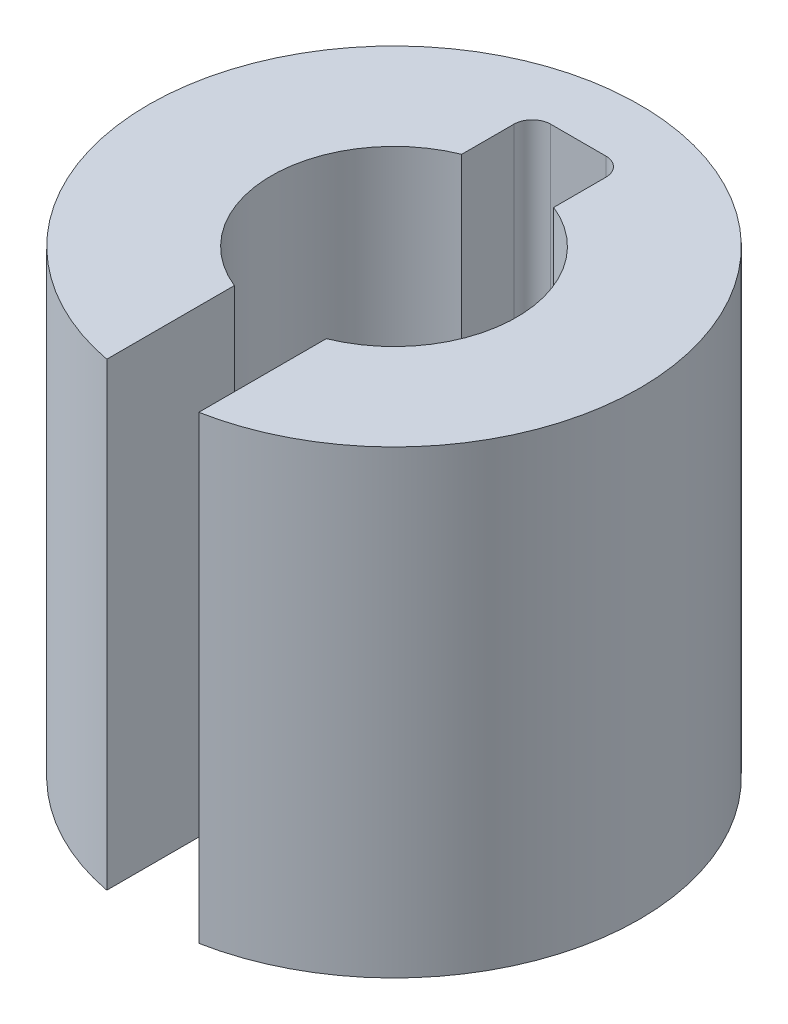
SolidWorks part; units mm, degrees
other "<217-2625-011 Rev1>-<Imported1>"
ref_plane "Front Plane" through (0, 0, 0) normal (0, 0, 1) x (1, 0, 0)
ref_plane "Top Plane" through (0, 0, 0) normal (0, 1, 0) x (1, 0, 0)
ref_plane "Right Plane" through (0, 0, 0) normal (1, 0, 0) x (0, 0, -1)
mirrored part "217-2625-011 Rev1_Mirrored"
